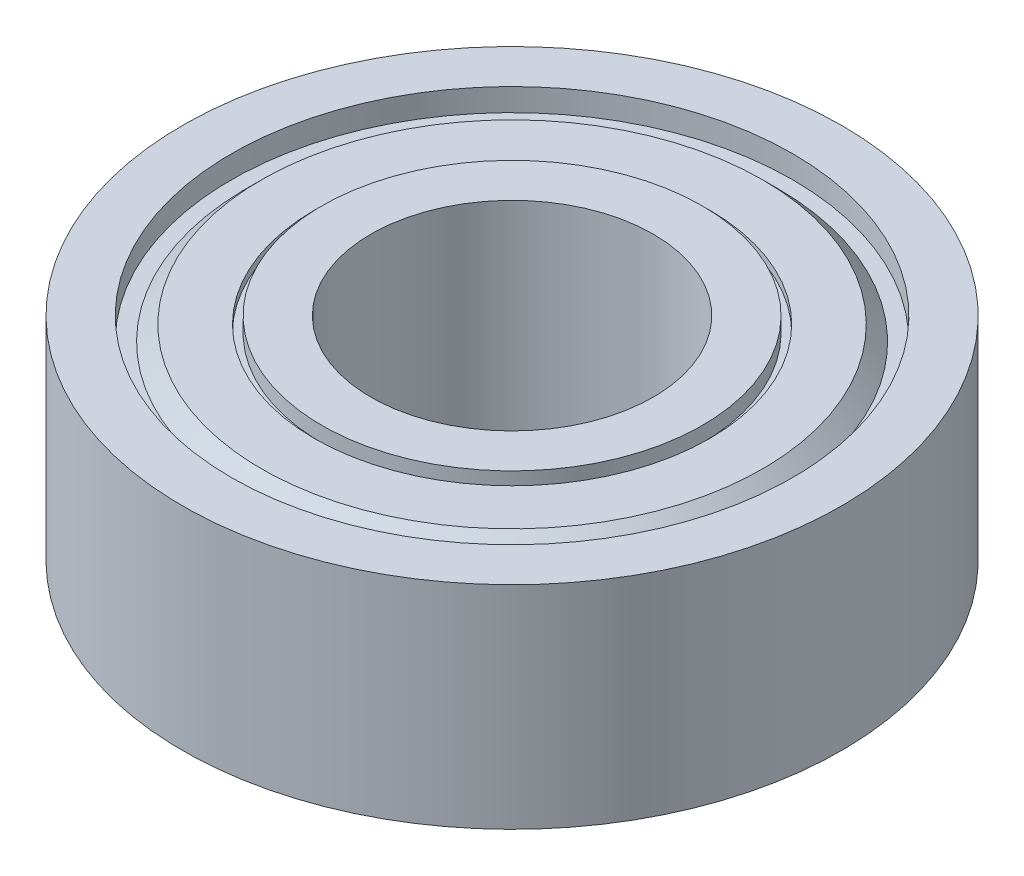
SolidWorks part; units mm, degrees
ref_plane "FRONT" through (0, 0, 0) normal (0, 0, 1) x (1, 0, 0)
ref_plane "TOP" through (0, 0, 0) normal (0, 1, 0) x (1, 0, 0)
ref_plane "RIGHT" through (0, 0, 0) normal (1, 0, 0) x (0, 0, -1)
sketch "Sketch1" plane through (0, 0, 0) normal (0, 0, 1) x (1, 0, 0)
  line L0 (0, 0) -> (0, 26.1616) construction
  line L1 (4.7625, 0) -> (4.7625, 7.1437)
  line L2 (11.1125, 0) -> (11.1125, 7.1437)
  line L3 (11.1125, 7.1437) -> (9.4615, 7.1437)
  line L4 (9.4615, 7.1437) -> (9.4615, 6.3818)
  line L5 (9.4615, 6.3818) -> (8.9535, 6.3817)
  line L6 (8.9535, 6.3817) -> (8.4455, 6.8897)
  line L7 (8.4455, 6.8897) -> (6.6675, 6.8897)
  line L8 (6.6675, 6.8897) -> (6.6675, 6.6357)
  line L9 (4.7625, 7.1437) -> (6.4135, 7.1437)
  line L10 (6.4135, 7.1437) -> (6.4135, 6.6357)
  line L11 (6.4135, 6.6357) -> (6.6675, 6.6357)
  line L12 (0, 0) -> (8.0444, 0) construction
  line L13 (11.1125, 3.5719) -> (23.328, 3.5719) construction
  line L14 (6.4135, 0.508) -> (6.6675, 0.508)
  line L15 (6.4135, 0) -> (6.4135, 0.508)
  line L16 (4.7625, 0) -> (6.4135, 0)
  line L17 (6.6675, 0.254) -> (6.6675, 0.508)
  line L18 (8.4455, 0.254) -> (6.6675, 0.254)
  line L19 (8.9535, 0.762) -> (8.4455, 0.254)
  line L20 (9.4615, 0.762) -> (8.9535, 0.762)
  line L21 (9.4615, 0) -> (9.4615, 0.762)
  line L22 (11.1125, 0) -> (9.4615, 0)
  dimension "D1" = 9.525
  dimension "D2" = 22.225
  dimension "D3" = 7.1437
  dimension "D4" = 1.651
  dimension "D5" = 0.254
  dimension "D6" = 0.254
  dimension "D7" = 0.508
  dimension "D8" = 0.762
  dimension "D9" = 135
  dimension "D10" = 0.508
revolve "Base-Revolve" add sketch "Sketch1" angle 360 about L0
